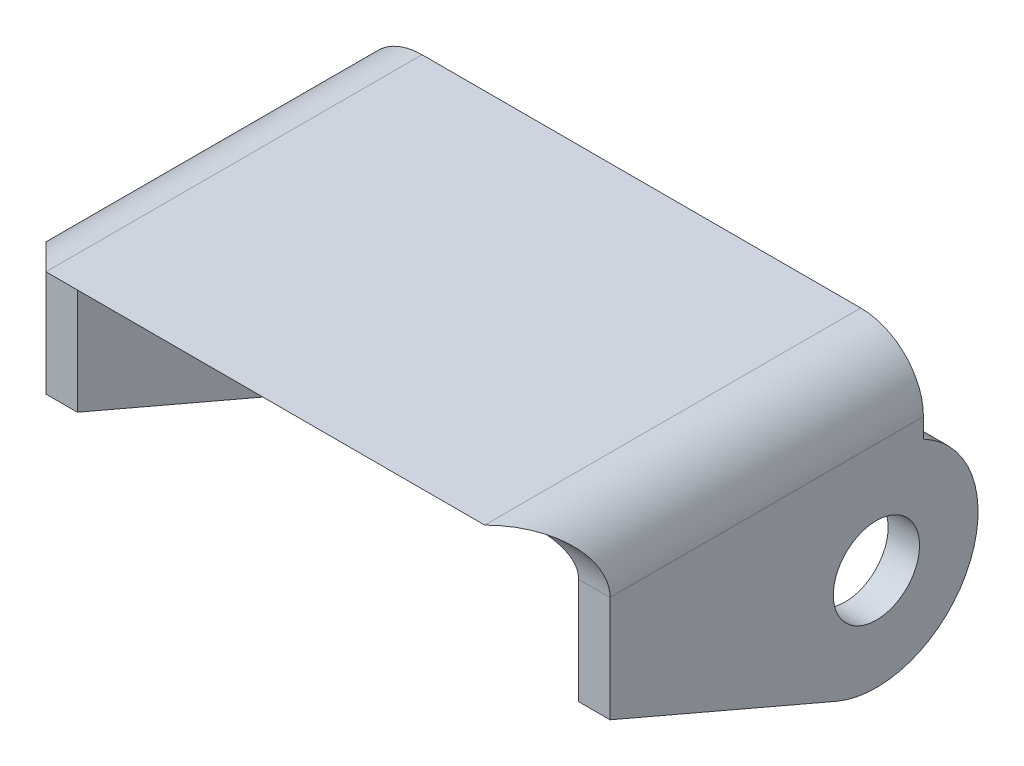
SolidWorks part; units mm, degrees
ref_plane "Front Plane" through (0, 0, 0) normal (0, 0, 1) x (1, 0, 0)
ref_plane "Top Plane" through (0, 0, 0) normal (0, 1, 0) x (1, 0, 0)
ref_plane "Right Plane" through (0, 0, 0) normal (1, 0, 0) x (0, 0, -1)
sketch "Sketch1" plane through (0, 0, 0) normal (0, 0, 1) x (1, 0, 0)
  line L0 (153.4266, 90.5686) -> (147.0766, 90.5686)
  line L1 (147.0766, 90.5686) -> (147.0766, 135.0186)
  line L2 (159.7766, 147.7186) -> (248.6766, 147.7186)
  line L3 (261.3766, 135.0186) -> (261.3766, 90.5686)
  line L4 (261.3766, 90.5686) -> (255.0266, 90.5686)
  line L5 (255.0266, 90.5686) -> (255.0266, 135.0186)
  line L6 (248.6766, 141.3686) -> (159.7766, 141.3686)
  line L7 (153.4266, 135.0186) -> (153.4266, 90.5686)
  arc A0 (159.7766, 147.7186) -> (147.0766, 135.0186) centre (159.7766, 135.0186) ccw
  arc A1 (261.3766, 135.0186) -> (248.6766, 147.7186) centre (248.6766, 135.0186) ccw
  arc A2 (255.0266, 135.0186) -> (248.6766, 141.3686) centre (248.6766, 135.0186) ccw
  arc A3 (159.7766, 141.3686) -> (153.4266, 135.0186) centre (159.7766, 135.0186) ccw
extrude "Extrude1" add sketch "Sketch1" along normal blind 88.9
sketch "Sketch2" plane through (261.3766, 0, 0) normal (1, 0, 0) x (0, 0, -1)
  line L0 (-88.9, 147.7186) -> (0, 147.7186) construction
  line L1 (0, 135.0186) -> (0, 147.7186) construction
  circle A0 centre (-22.225, 112.7936) radius 8.7313
  dimension "D1" = 17.4625
  dimension "D2" = 34.925
  dimension "D3" = 22.225
extrude "Extrude2" cut sketch "Sketch2" against normal through all
sketch "Sketch3" plane through (261.3766, 0, 0) normal (1, 0, 0) x (0, 0, -1)
  line L0 (-30.3479, 93.8676) -> (-76.2, 113.547)
  line L1 (-76.2, 113.547) -> (-76.2, 135.0186)
  line L2 (-88.9, 147.7186) -> (-115.7826, 147.7186)
  line L3 (-115.7826, 80.3653) -> (-115.7826, 147.7186)
  line L4 (-12.7, 147.7186) -> (-12.7, 131.0542)
  line L5 (-88.9, 147.7186) -> (0, 147.7186) construction
  line L6 (0, 135.0186) -> (0, 147.7186) construction
  line L7 (-12.7, 147.7186) -> (0, 147.7186)
  line L8 (0, 147.7186) -> (0, 83.6941)
  line L9 (0, 83.6941) -> (-115.7826, 80.3653)
  line L10 (0, 90.5686) -> (0, 135.0186) construction
  arc A0 (-30.3479, 93.8676) -> (-12.7, 131.0542) centre (-22.225, 112.7936) ccw
  arc A1 (-76.2, 135.0186) -> (-88.9, 147.7186) centre (-88.9, 135.0186) ccw
  dimension "D1" = 12.7
  dimension "D2" = 12.7
  dimension "D3" = 76.2
extrude "Extrude3" cut sketch "Sketch3" against normal through all
ref_plane "Plane1" through (204.2266, 0, 0) normal (-1, 0, 0) x (0, 0, 1)
